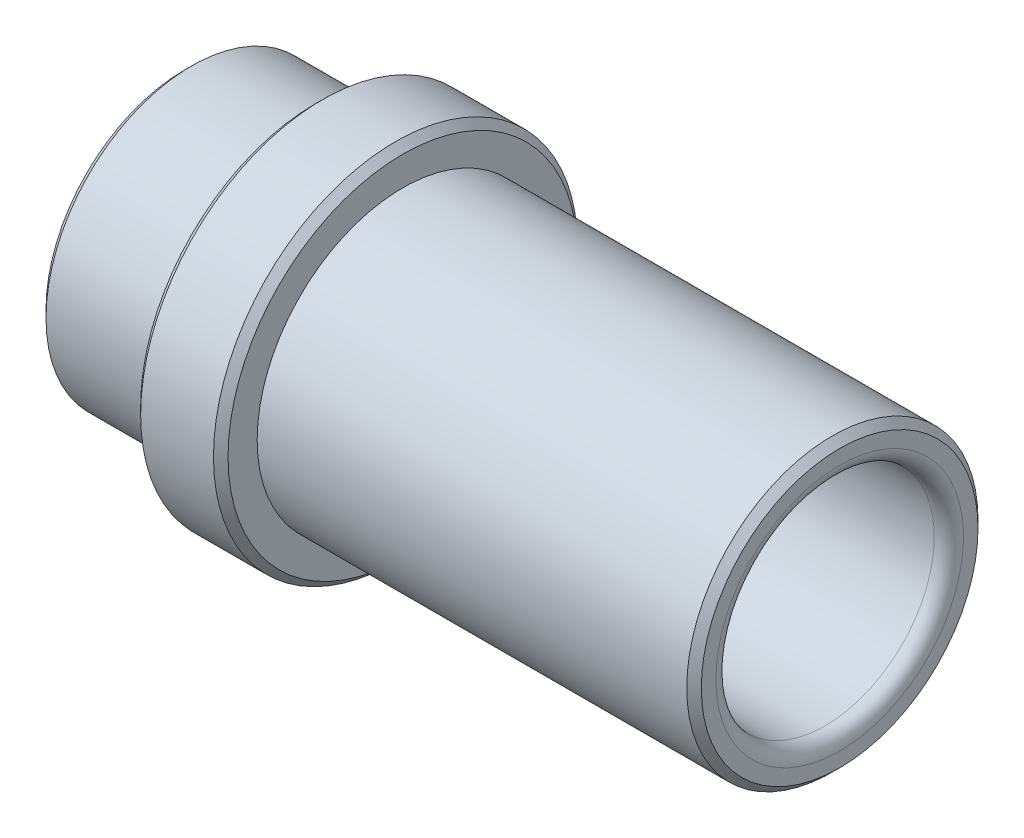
SolidWorks part; units mm, degrees
ref_plane "Plan de face" through (0, 0, 0) normal (0, 0, 1) x (1, 0, 0)
ref_plane "Plan de dessus" through (0, 0, 0) normal (0, 1, 0) x (1, 0, 0)
ref_plane "Plan de droite" through (0, 0, 0) normal (1, 0, 0) x (0, 0, -1)
sketch "Esquisse1" plane through (0, 0, 0) normal (0, 0, 1) x (1, 0, 0)
  line L0 (-64.6395, 0) -> (79.9877, 0) construction
  line L1 (0, 7.5) -> (0, 10)
  line L2 (0, 10) -> (9, 10)
  line L3 (9, 10) -> (9, 12.5)
  line L4 (9, 12.5) -> (15, 12.5)
  line L5 (15, 12.5) -> (15, 10)
  line L6 (15, 10) -> (45, 10)
  line L7 (45, 10) -> (45, 7.5)
  line L8 (45, 7.5) -> (0, 7.5)
  dimension "D1" = 15
  dimension "D2" = 20
  dimension "D3" = 25
  dimension "D4" = 6
  dimension "D5" = 9
  dimension "D6" = 36
revolve "Révolution1" add sketch "Esquisse1" angle 360 about L0
chamfer "Chanfrein1" distance 0.5 angle 45 4 edges at (45, 0, 10) (15, 0, 12.5) (9, 0, 12.5) (0, 0, 10)
fillet "Congé1" radius 1 2 edges at (0, 0, 7.5) (45, 0, 7.5)
